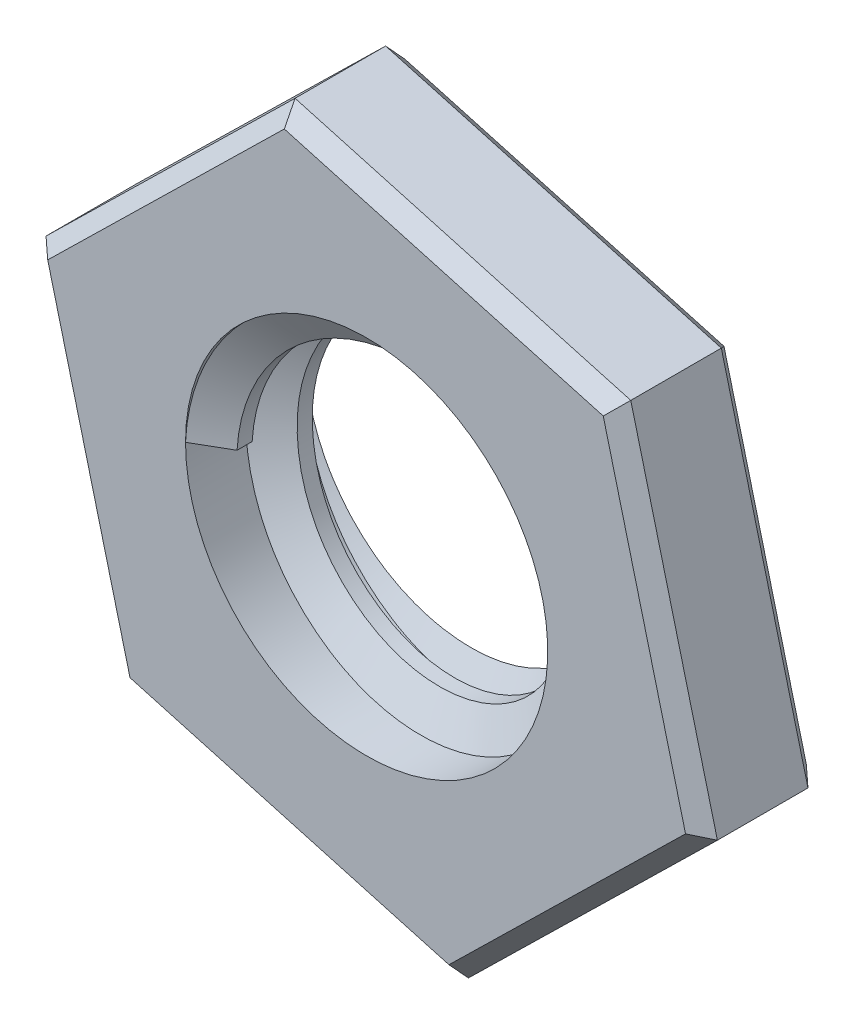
SolidWorks part; units mm, degrees
ref_plane "Front Plane" through (0, 0, 0) normal (0, 0, 1) x (1, 0, 0)
ref_plane "Top Plane" through (0, 0, 0) normal (0, 1, 0) x (1, 0, 0)
ref_plane "Right Plane" through (0, 0, 0) normal (1, 0, 0) x (0, 0, -1)
sketch "Sketch1" plane through (0, 0, 0) normal (0, 0, 1) x (1, 0, 0)
  line L1 (51.775, -41.9916) -> (46.2144, -40.4383)
  line L2 (46.2144, -40.4383) -> (42.0889, -44.4774)
  line L3 (42.0889, -44.4774) -> (43.5241, -50.0697)
  line L4 (43.5241, -50.0697) -> (49.0848, -51.6229)
  line L5 (49.0848, -51.6229) -> (53.2102, -47.5838)
  line L6 (53.2102, -47.5838) -> (51.775, -41.9916)
  circle A0 centre (47.6496, -46.0306) radius 5 construction
  circle A1 centre (47.6496, -46.0306) radius 3
extrude "Boss-Extrude1" add sketch "Sketch1" along normal blind 2
chamfer "Chamfer1" distance 0.25 12 edges at (44.1516, -42.4579, 0) (42.8065, -47.2735, 0) (46.3044, -50.8463, 0) (51.1475, -49.6034, 0) (52.4926, -44.7877, 0) (48.9947, -41.2149, 0) (44.1516, -42.4579, 2) (42.8065, -47.2735, 2) (46.3044, -50.8463, 2) (51.1475, -49.6034, 2) (52.4926, -44.7877, 2) (48.9947, -41.2149, 2)
thread "Thread1" pitch 1 start angle 0, offset 0, length 0, pitch 1, diameter 6
ref_plane "Plane1" through (44.6496, -46.0306, 2) normal (0, -1, 0) x (-1, 0, 0)
sketch "Thread Profile1" plane through (44.6496, -46.0306, 2) normal (0, -1, 0) x (-1, 0, 0)
  line L0 (0, 0) -> (0, 1) construction
  line L11 (0, 0) -> (0, 0.875)
  line L12 (0, 0.875) -> (-0.5413, 0.5625)
  line L13 (-0.5413, 0.5625) -> (-0.5413, 0.3125)
  line L15 (-0.5413, 0.3125) -> (0, 0)
  line L17 (-0.5413, 0.4375) -> (0, 0.4375) construction
  point P2 (0, 0)
  dimension "Pitch" = 1
  dimension "Profile_Angle" = 60
  dimension "Profile_Land" = 0.25
  dimension "Profile_Height" = 0.5413
